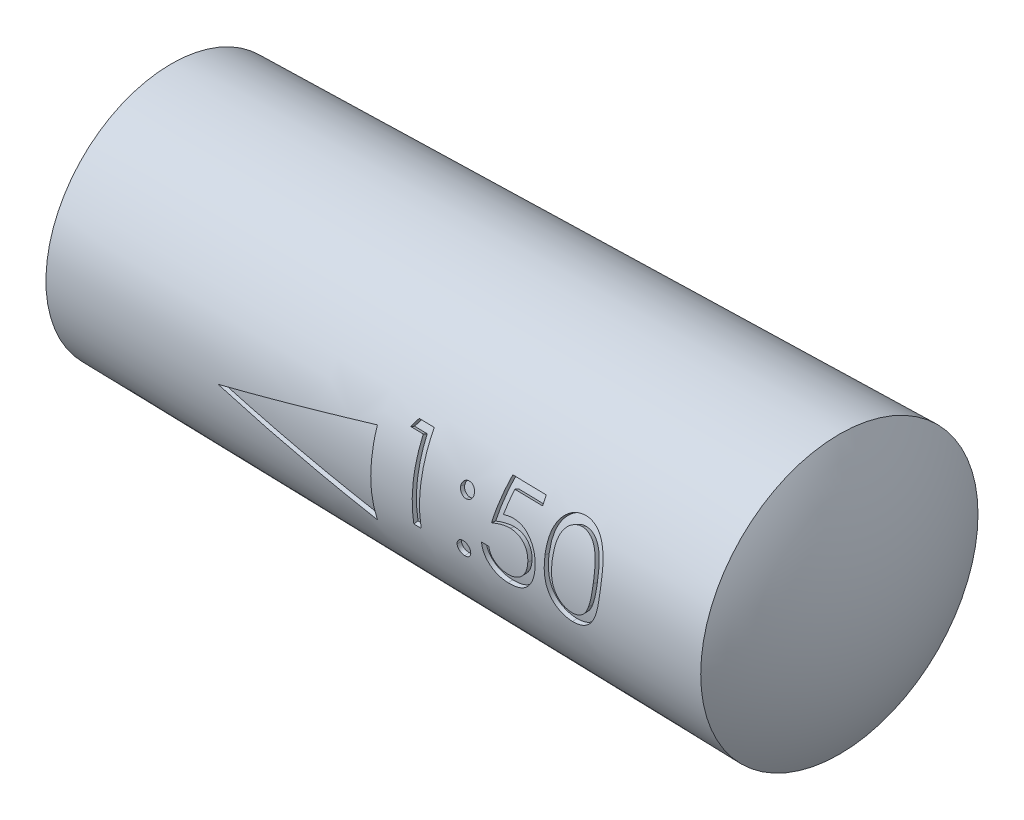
SolidWorks part; units mm, degrees
ref_plane "Front Plane" through (0, 0, 0) normal (0, 0, 1) x (1, 0, 0)
ref_plane "Top Plane" through (0, 0, 0) normal (0, 1, 0) x (1, 0, 0)
ref_plane "Right Plane" through (0, 0, 0) normal (1, 0, 0) x (0, 0, -1)
sketch "Sketch1" plane through (0, 0, 0) normal (1, 0, 0) x (0, 0, -1)
  circle A0 centre (0, 0) radius 1.5
  dimension "D1" = 3
extrude "Extrude1" add sketch "Sketch1" along normal mid plane 8
draft "Draft1" type of draft neutral plane draft angle 1.146 faces to draft 1 parameters "D1"=1.146
sketch "Sketch2" plane through (0, 0, 0) normal (0, 0, 1) x (1, 0, 0)
  line L0 (-4, 0) -> (-4, 1.5)
  line L1 (-4, 1.5) -> (-4, -1.5) construction
  line L2 (-4, 0) -> (-4.45, 0)
  line L3 (-4.45, 0) -> (-4.45, -1.58) construction
  line L4 (4, 0) -> (4, 1.66)
  line L5 (4, -1.66) -> (4, 1.66) construction
  line L6 (4, 0) -> (4.45, 0)
  line L7 (4.45, 0) -> (4.45, -1.58) construction
  line L8 (-4, -1.5) -> (4, -1.66) construction
  arc A0 (-4.45, 0) -> (-4, 1.5) centre (-1.725, 0) cw
  arc A1 (4.45, 0) -> (4, 1.66) centre (1.1632, 0) ccw
  point P14 (0, -1.58)
revolve "Revolve1" add sketch "Sketch2" angle 360 about L2
sketch "Sketch5" plane through (0, 0, 0) normal (0, 0, 1) x (1, 0, 0)
  line L0 (0, 1.58) -> (0, -1.58) construction
  line L1 (4, 1.66) -> (-4, 1.5) construction
  line L2 (-4, -1.5) -> (4, -1.66) construction
ref_plane "Plane2" through (0, 0, 0) normal (-0.02, 0, 0.9998) x (0.9998, 0, 0.02)
sketch "Sketch6" plane through (0, 0, 0) normal (-0.02, 0, 0.9998) x (0.9998, 0, 0.02)
  line L0 (0, 0) -> (0, 0.5)
  line L1 (0, 1.58) -> (0, -1.58) construction
  line L2 (0, 0.5) -> (-1.866, 0)
  line L3 (-1.866, 0) -> (0, -0.5)
  line L4 (0, -0.5) -> (0, 0)
  line L5 (0, -0.25) -> (3, -0.25) construction
  text T0 "1:50" font "Century Gothic" height 1
  dimension "D1" = 1
  dimension "D2" = 30
  dimension "D3" = 3
wrap "Wrap2" sketch "Sketch6" wrap type deboss source sketch "Sketch6" thickness 0.05 parameters "D1"=0.05
equation "\"D2@Sketch2\" = \"D1@Sketch2\""
